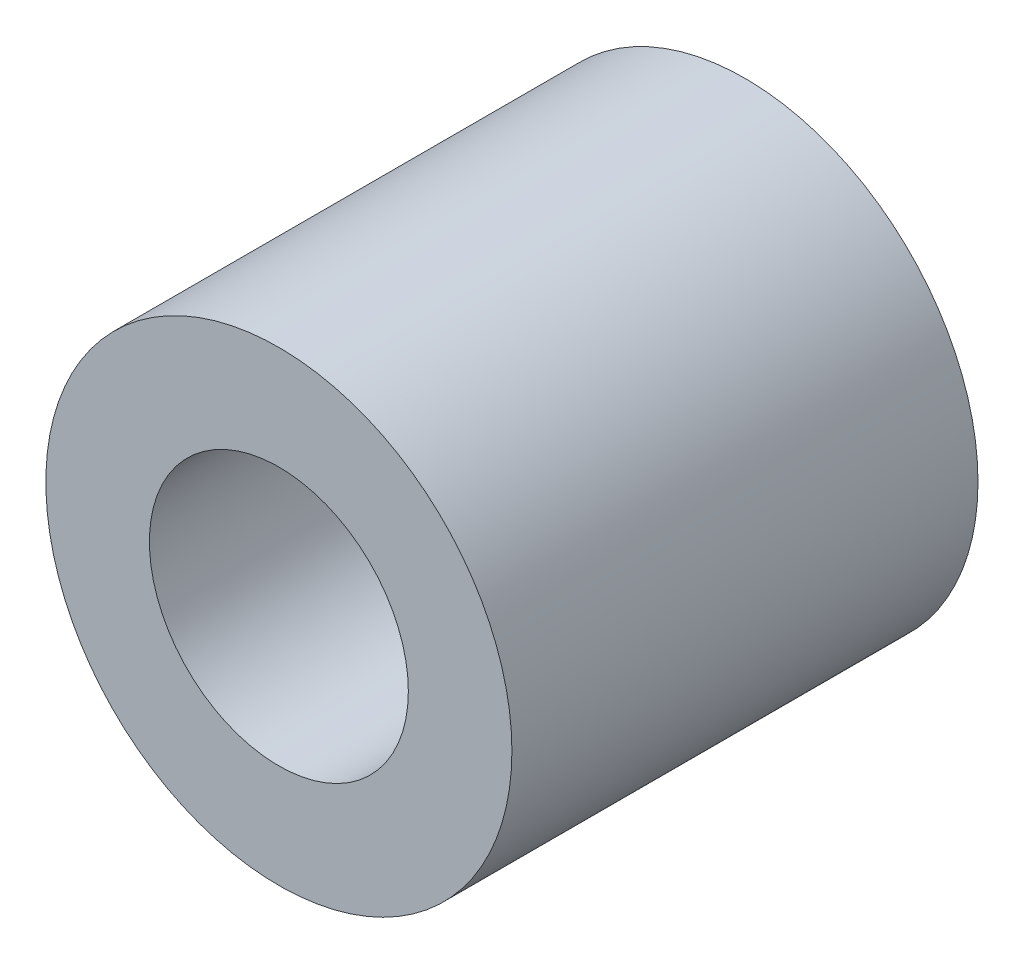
SolidWorks part; units mm, degrees
ref_plane "Plane1" through (0, 0, 0) normal (0, 0, 1) x (1, 0, 0)
ref_plane "Plane2" through (0, 0, 0) normal (0, 1, 0) x (1, 0, 0)
ref_plane "Plane3" through (0, 0, 0) normal (1, 0, 0) x (0, 0, -1)
sketch "Sketch1" plane through (0, 0, 0) normal (0, 0, 1) x (1, 0, 0)
  circle A0 centre (0, 0) radius 4.5
  dimension "D1" = 9
extrude "insert shape" add sketch "Sketch1" along normal blind 9
sketch "Sketch2" plane through (0, 0, 9) normal (0, 0, 1) x (1, 0, 0)
  line L0 (0, 0) -> (0, 5.7005) construction
  line L1 (-0.05, 4.4997) -> (0, 4.5997)
  line L2 (0.05, 4.4997) -> (0, 4.5997)
  line L3 (-0.05, 4.4997) -> (0.05, 4.4997)
  circle A0 centre (0, 0) radius 4.5 construction
  dimension "D1" = 0.1
  dimension "D2" = 0.1
extrude "grip ribs" [suppressed] add sketch "Sketch2" along normal up to surface (9 mm away)
pattern_circular "copy grip ribs" [suppressed] count 24 every 15
sketch "Sketch3" plane through (0, 0, 9) normal (0, 0, 1) x (1, 0, 0)
  circle A0 centre (0, 0) radius 2.5
  dimension "D1" = 5
extrude "center hole" cut sketch "Sketch3" against normal blind 4.3
sketch "Sketch4" plane through (0, 0, 4.7) normal (0, 0, 1) x (1, 0, 0)
  circle A0 centre (0, 0) radius 1.75
  dimension "D1" = 3.5
extrude "tapped hole" cut sketch "Sketch4" against normal up to next
equation "\"result\"= 0.000443"
equation "\"result\"= 1*1"
equation "\"result\"= 1.000000*2.500000"
